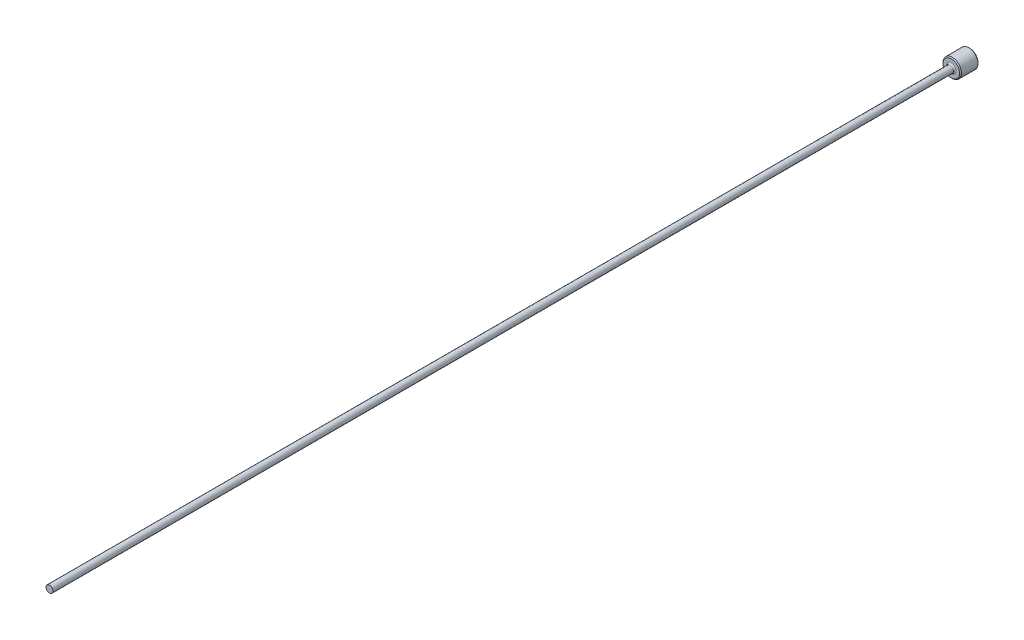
SolidWorks part; units mm, degrees
ref_plane "Front Plane" through (0, 0, 0) normal (0, 0, 1) x (1, 0, 0)
ref_plane "Top Plane" through (0, 0, 0) normal (0, 1, 0) x (1, 0, 0)
ref_plane "Right Plane" through (0, 0, 0) normal (1, 0, 0) x (0, 0, -1)
sketch "Sketch1" plane through (0, 0, 0) normal (1, 0, 0) x (0, 0, -1)
  line L0 (0, 0) -> (0, 2)
  line L1 (0, 2.2) -> (0, -2.2) construction
  line L2 (0, 2) -> (-4, 2)
  line L3 (-4, 2) -> (-4, 1.05)
  line L4 (-4.3, 0.75) -> (-200, 0.75)
  line L5 (-200, 0.75) -> (-200, 0)
  line L6 (2.2, 0) -> (-2.2, 0) construction
  line L7 (-200, 0) -> (0, 0)
  line L8 (-109.0506, 0) -> (16.9928, 0) construction
  arc A0 (-4, 1.05) -> (-4.3, 0.75) centre (-4.3, 1.05) cw
  dimension "D1" = 0.3
  dimension "D2" = 4
  dimension "D3" = 1.5
  dimension "D4" = 200
  dimension "D5" = 4
revolve "Revolve1" add sketch "Sketch1" angle 360 about L8
chamfer "Chamfer1" distance 0.2 angle 45 2 edges at (2, 0, 0) (2, 0, 4)
